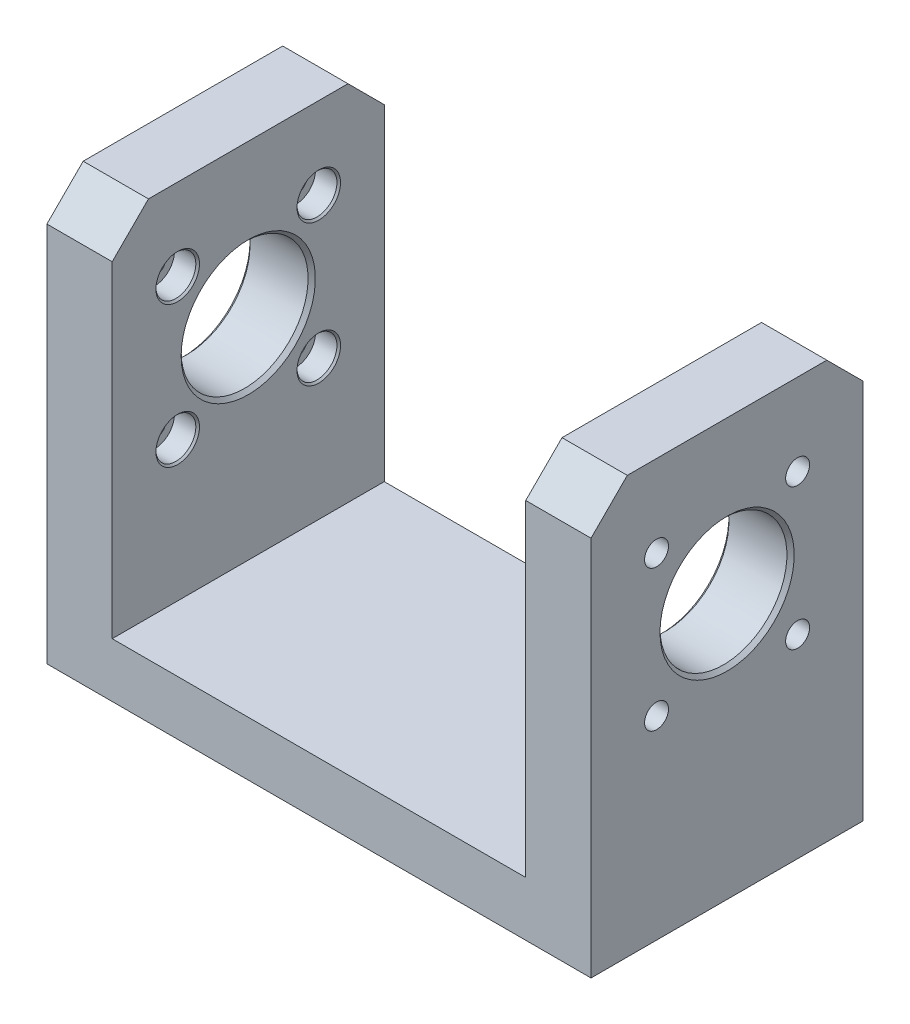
SolidWorks part; units mm, degrees
ref_plane "Front" through (0, 0, 0) normal (0, 0, 1) x (1, 0, 0)
ref_plane "Top" through (0, 0, 0) normal (0, 1, 0) x (1, 0, 0)
ref_plane "Right" through (0, 0, 0) normal (1, 0, 0) x (0, 0, -1)
sketch "Sketch1" plane through (0, 0, 0) normal (0, 1, 0) x (1, 0, 0)
  line L1 (75, -37.5) -> (-75, -37.5)
  line L2 (75, -37.5) -> (75, 37.5)
  line L3 (75, 37.5) -> (-75, 37.5)
  line L4 (-75, -37.5) -> (-75, 37.5)
  line L5 (75, -37.5) -> (-75, 37.5) construction
  line L6 (75, 37.5) -> (-75, -37.5) construction
  point P0 (0, 0)
  dimension "D1" = 75
  dimension "D2" = 150
extrude "Boss-Extrude1" add sketch "Sketch1" along normal blind 15
sketch "Sketch2" plane through (0, 15, 0) normal (0, 1, 0) x (1, 0, 0)
  line L0 (-57, 37.5) -> (-57, -37.5)
  line L4 (-75, 37.5) -> (-75, -37.5)
  line L5 (-75, -37.5) -> (75, -37.5)
  line L6 (75, -37.5) -> (75, 37.5)
  line L7 (75, 37.5) -> (-75, 37.5)
  line L8 (-75, 37.5) -> (-75, -37.5)
  line L9 (-75, -37.5) -> (-57, -37.5)
  line L11 (-57, 37.5) -> (-75, 37.5)
  dimension "D2" = 18
  dimension "D1" = 0
extrude "Boss-Extrude2" add sketch "Sketch2" along normal blind 100
sketch "Sketch3" plane through (-75, 0, 0) normal (-1, 0, 0) x (0, 0, 1)
  line L1 (-37.5, 115) -> (37.5, 115) construction
  circle A0 centre (0, 73) radius 17.5
  dimension "D1" = 35
  dimension "D2" = 42
extrude "Cut-Extrude1" cut sketch "Sketch3" against normal up to next
hole_wizard "CBORE for M6 Hex Socket Head Cap Screw1" positions "Sketch5" profile "Sketch4" counterbore size "M6" standard "ISO"
sketch "Sketch5" plane through (-57, 0, 0) normal (1, 0, 0) x (0, 0, -1)
  line L0 (0, 100.5) -> (0, 73) construction
  line L1 (0, 73) -> (19.4454, 92.4454) construction
  circle A0 centre (0, 73) radius 27.5 construction
  point P0 (19.4454, 92.4454)
  dimension "D1" = 55
  dimension "D2" = 45
sketch "Sketch4" plane through (-57, 92.4454, -19.4454) normal (0, 1, 0) x (0, 0, -1)
  line L0 (0, 0) -> (0, 18)
  line L1 (0, 18) -> (3.3, 18)
  line L3 (3.3, 18) -> (3.3, 6.4)
  line L4 (5.5, 6.4) -> (3.3, 6.4)
  line L5 (5.5, 6.4) -> (5.5, 0.5)
  line L6 (5.5, 0.5) -> (6, 0)
  line L7 (6, 0) -> (0, 0)
  line L8 (-5.5, 0.5) -> (-6, 0) construction
  line L11 (0, -6.35) -> (0, 107.95) construction
  dimension "Thru Hole Dia." = 6.6
  dimension "Thru Hole Depth" = 18
  dimension "C'Bore Dia." = 11
  dimension "C'Bore Depth" = 6.4
  dimension "Near C'Sink Dia." = 12
  dimension "Near C'Sink Angle" = 90
pattern_circular "CirPattern1" count 4 over 360 about axis through (0, 73, 0) along (1, 0, 0) of "CBORE for M6 Hex Socket Head Cap Screw1"
chamfer "Chamfer1" distance 10 angle 45 2 edges at (-66, 115, -37.5) (-66, 115, 37.5)
hole_wizard "M4 Tapped Hole1" positions "Sketch7" profile "Sketch6" tap size "M4" standard "ISO"
sketch "Sketch7" plane through (0, 0, -37.5) normal (0, 0, -1) x (-1, 0, 0)
  line L0 (57, 105) -> (57, 15) construction
  line L1 (57, 115) -> (75, 115) construction
  point P0 (61, 95)
  point P1 (61, 25)
  dimension "D1" = 4
  dimension "D2" = 20
  dimension "D3" = 70
sketch "Sketch6" plane through (-61, 95, -37.5) normal (1, 0, 0) x (0, 1, 0)
  line L0 (0, 0) -> (0, 10.4914)
  line L1 (0, 10.4914) -> (1.65, 9.5)
  line L2 (1.65, 9.5) -> (1.65, 0)
  line L5 (1.65, 0) -> (0, 0)
  line L10 (0, 10.4914) -> (-1.65, 9.5) construction
  line L11 (0, -6.35) -> (0, 107.95) construction
  dimension "Tap Drill Dia." = 3.3
  dimension "Tap Drill Depth" = 9.5
  dimension "Drill Angle" = 118
chamfer "Chamfer2" distance 1 angle 45 2 edges at (-57, 73, 17.5) (-75, 73, 17.5)
mirror "Mirror2" about plane through (0, 0, 0) normal (1, 0, 0) of "Boss-Extrude2", "Cut-Extrude1", "CBORE for M6 Hex Socket Head Cap Screw1", "CirPattern1", "Chamfer1", "Chamfer2"
